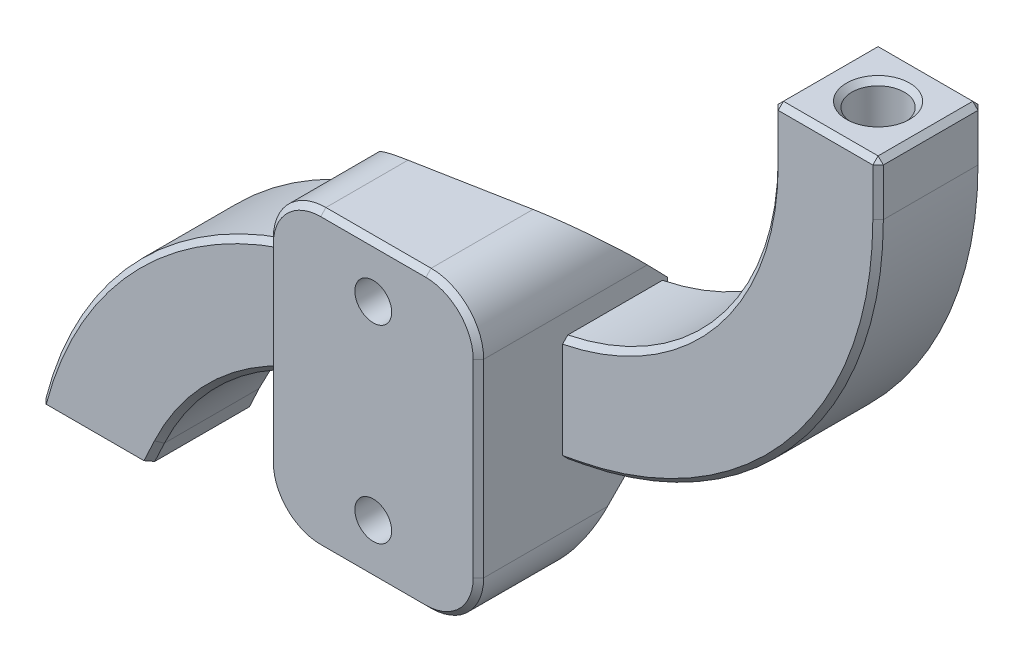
SolidWorks part; units mm, degrees
ref_plane "Ebene vorne" through (0, 0, 0) normal (0, 0, 1) x (1, 0, 0)
ref_plane "Ebene oben" through (0, 0, 0) normal (0, 1, 0) x (1, 0, 0)
ref_plane "Ebene rechts" through (0, 0, 0) normal (1, 0, 0) x (0, 0, -1)
sketch "Skizze1" plane through (0, 0, 0) normal (0, 0, 1) x (1, 0, 0)
  line L1 (40, -30) -> (-40, -30)
  line L2 (40, -30) -> (40, 30)
  line L3 (40, 30) -> (-40, 30)
  line L4 (-40, -30) -> (-40, 30)
  line L5 (40, -30) -> (-40, 30) construction
  line L6 (40, 30) -> (-40, -30) construction
  point P0 (0, 0)
  dimension "D1" = 60
  dimension "D2" = 80
extrude "Aufsatz-Linear austragen1" add sketch "Skizze1" along normal mid plane 10
sketch "Skizze2" plane through (0, 0, 0) normal (0, 0, 1) x (1, 0, 0)
  line L0 (-35, -30) -> (-32.8869, -25.4685)
  line L1 (-40, -30) -> (40, -30) construction
  line L2 (-11.3507, -8.6844) -> (10.653, -4.4626)
  line L3 (35, 25) -> (35, 30)
  line L4 (40, 30) -> (-40, 30) construction
  line L5 (-40, 30) -> (-40, -30) construction
  line L6 (40, -30) -> (40, 30) construction
  arc A0 (-32.8869, -25.4685) -> (-11.3507, -8.6844) centre (-5.6977, -38.147) cw
  arc A1 (10.653, -4.4626) -> (35, 25) centre (5, 25) ccw
  dimension "D4" = 30
  dimension "D1" = 5
  dimension "D2" = 5
  dimension "D3" = 5
  dimension "D5" = 5
  dimension "D6" = 65
sketch "Skizze3" plane through (0, 30, 0) normal (0, 1, 0) x (1, 0, 0)
  line L0 (10.653, 0) -> (35, 0) construction
  line L1 (40, -5) -> (40, 5) construction
  circle A0 centre (35, 0) radius 2.5
  dimension "D1" = 5
  dimension "D2" = 5
sketch "Skizze4" plane through (0, 0, 5) normal (0, 0, 1) x (1, 0, 0)
  line L4 (40, 30) -> (-40, 30) construction
  line L5 (-40, 30) -> (-40, -30) construction
  line L6 (40, -30) -> (40, 30) construction
  line L7 (-30.4685, -32.1131) -> (-28.3554, -27.5816)
  line L8 (-10.4085, -13.5949) -> (11.5952, -9.373)
  line L9 (40, 25) -> (40, 30)
  line L10 (-29.4831, -30) -> (-28.3554, -27.5816)
  line L11 (-10.4085, -13.5949) -> (11.5952, -9.373)
  line L13 (-39.5315, -27.8869) -> (-37.4184, -23.3554)
  line L14 (-12.2928, -3.774) -> (9.7108, 0.4478)
  line L15 (30, 25) -> (30, 30)
  line L17 (-12.2928, -3.774) -> (9.7108, 0.4478)
  line L18 (30, 25) -> (30, 30)
  line L19 (-40, -30) -> (40, -30) construction
  line L20 (30, 30) -> (-40, 30)
  line L21 (-40, 30) -> (-40, -31.1936)
  line L22 (40, -30) -> (40, 25)
  line L23 (-29.4831, -30) -> (40, -30)
  arc A4 (-10.4085, -13.5949) -> (-28.3554, -27.5816) centre (-5.6977, -38.147) ccw
  arc A5 (11.5952, -9.373) -> (40, 25) centre (5, 25) ccw
  arc A6 (-10.4085, -13.5949) -> (-28.3554, -27.5816) centre (-5.6977, -38.147) ccw
  arc A7 (11.5952, -9.373) -> (40, 25) centre (5, 25) ccw
  arc A8 (-12.2928, -3.774) -> (-37.4184, -23.3554) centre (-5.6977, -38.147) ccw
  arc A9 (9.7108, 0.4478) -> (30, 25) centre (5, 25) ccw
  arc A10 (-12.2928, -3.774) -> (-40, -31.1936) centre (-5.6977, -38.147) ccw
  arc A11 (9.7108, 0.4478) -> (30, 25) centre (5, 25) ccw
  dimension "D1" = 5
  dimension "D2" = 5
extrude "Schnitt-Linear austragen1" cut sketch "Skizze4" against normal through all
sweep "Schnitt-Austragung1" cut profiles "Skizze3" path "Skizze2"
sketch "Skizze5" plane through (0, 0, 5) normal (0, 0, 1) x (1, 0, 0)
  line L0 (0, -6.5) -> (0, 0) construction
  line L1 (-10, -20.5) -> (10, -20.5)
  line L2 (-10, -20.5) -> (-10, 7.5)
  line L3 (-10, 7.5) -> (10, 7.5)
  line L4 (10, -20.5) -> (10, 7.5)
  line L5 (-10, -20.5) -> (10, 7.5) construction
  line L6 (-10, 7.5) -> (10, -20.5) construction
  point P0 (0, -6.5)
  dimension "D1" = 20
  dimension "D2" = 6.5
  dimension "D3" = 28
extrude "Aufsatz-Linear austragen2" add sketch "Skizze5" along normal blind 8
fillet "Verrundung1" radius 5 4 edges at (10, -20.5, 9) (-10, -20.5, 9) (10, 7.5, 9) (-10, 7.5, 9)
chamfer "Fase1" distance 10 angle 45 3 edges at (0, -11.5978, 5) (9.8555, 0.476, 5) (-0.1446, -1.4431, 5)
chamfer "Fase2" distance 0.5 angle 45 38 edges at (-8.5355, -19.0355, 13) (-10, -6.5, 13) (-8.5355, 6.0355, 13) (0, 7.5, 13) (8.5355, 6.0355, 13) (10, -6.5, 13) (8.5355, -19.0355, 13) (0, -20.5, 13) (-39.7363, -30, 0) (-29.4831, -30, 0) (-32.2416, -30, 0) (40, 30, 0) (35, 30, 5) (30, 30, 0) (35, 30, -5) (37.5, 30, 0) (30, 27.5, 5) (24.3649, 9.1886, 5) (40, 27.5, 5) (10.7976, -9.526, 5) (31.9799, 2.7046, 5) (-10.2043, -13.5557, 5) (-28.9192, -28.7908, 5) (-21.0654, -18.4281, 5) (-11.1464, -3.554, 5) (-34.6097, -30, 5) (-29.8788, -12.8434, 5) (40, 27.5, -5) (10.7976, -9.526, -5) (31.9799, 2.7046, -5) (-10.2043, -13.5557, -5) (-28.9192, -28.7908, -5) (-21.0654, -18.4281, -5) (30, 27.5, -5) (24.3649, 9.1886, -5) (-11.1464, -3.554, -5) (-34.6097, -30, -5) (-29.8788, -12.8434, -5)
ref_plane "Ebene1" through (0, 0, 8) normal (0, 0, 1) x (1, 0, 0)
hole_wizard "Ø3.5 (3.5) Durchmesser Bohrung1" positions "Skizze6" profile "Skizze7" hole size "Ø3.5" standard "DIN"
sketch "Skizze6" plane through (0, 0, 13) normal (0, 0, 1) x (1, 0, 0)
  line L0 (-5, 7.5) -> (5, 7.5) construction
  line L1 (5, -20.5) -> (-5, -20.5) construction
  point P0 (0, 2.5)
  point P2 (0, -15.5)
  dimension "D1" = 5
  dimension "D2" = 5
sketch "Skizze7" plane through (0, 2.5, 13) normal (1, 0, 0) x (0, -1, 0)
  line L0 (0, 0) -> (0, 18)
  line L1 (0, 18) -> (1.75, 18)
  line L2 (1.75, 18) -> (1.75, 0)
  line L5 (1.75, 0) -> (0, 0)
  line L11 (0, -6.35) -> (0, 107.95) construction
  dimension "Bohrerdurchmesser" = 3.5
  dimension "Bohrungstiefe" = 18
sketch "Skizze8" plane through (0, 0, 8) normal (0, 0, 1) x (1, 0, 0)
  circle A0 centre (0, 2.5) radius 3.5
  circle A1 centre (0, -15.5) radius 3.5
  dimension "D1" = 7
extrude "Schnitt-Linear austragen2" cut sketch "Skizze8" against normal through all
